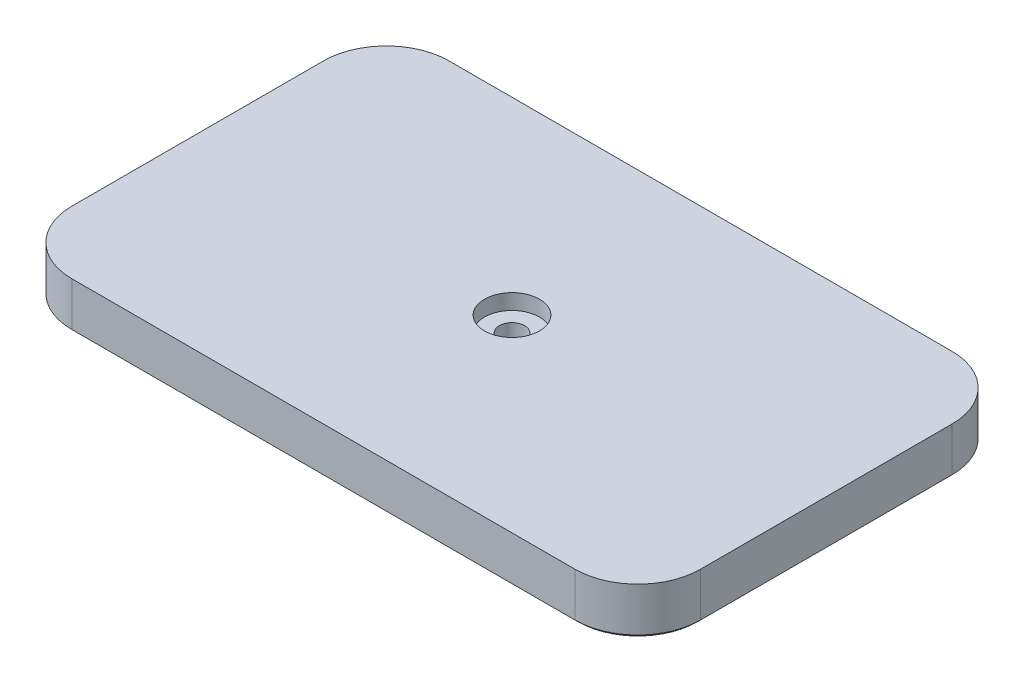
SolidWorks part; units mm, degrees
ref_plane "Plane1" through (0, 0, 0) normal (0, 0, 1) x (1, 0, 0)
ref_plane "Plane2" through (0, 0, 0) normal (0, 1, 0) x (1, 0, 0)
ref_plane "Plane3" through (0, 0, 0) normal (1, 0, 0) x (0, 0, -1)
sketch "Sketch1" plane through (0, 0, 0) normal (0, 1, 0) x (1, 0, 0)
  line L0 (-63.5, 38.1) -> (63.5, -38.1) construction
  line L1 (-63.5, 38.1) -> (63.5, 38.1)
  line L2 (-63.5, 38.1) -> (-63.5, -38.1)
  line L3 (-63.5, -38.1) -> (63.5, -38.1)
  line L4 (63.5, 38.1) -> (63.5, -38.1)
  dimension "D1" = 127
  dimension "D2" = 76.2
extrude "Extrude1" add sketch "Sketch1" along normal blind 9.525
fillet "Fillet1" radius 12.7 4 edges at (-63.5, 4.7625, -38.1) (63.5, 4.7625, -38.1) (-63.5, 4.7625, 38.1) (63.5, 4.7625, 38.1)
chamfer "Chamfer1" distance 0.635 angle 45 8 edges at (0, 0, 38.1) (63.5, 0, 0) (0, 0, -38.1) (-63.5, 0, 0) (-59.7803, 0, 34.3803) (59.7803, 0, 34.3803) (59.7803, 0, -34.3803) (-59.7803, 0, -34.3803)
hole_wizard "CBORE for #10 Binding Head Machine Screw2" positions "Sketch3" profile "Sketch2" counterbore size "#10" standard "Ansi Inch"
sketch "Sketch3" plane through (0, 9.525, 0) normal (0, 1, 0) x (-1, 0, 0)
  line L0 (50.8, -25.4) -> (-50.8, 25.4) construction
  point P0 (0, 0)
sketch "Sketch2" plane through (0, 9.525, 0) normal (1, 0, 0) x (0, 0, 1)
  line L0 (0, 0) -> (0, 9.525)
  line L1 (0, 9.525) -> (2.5527, 9.525)
  line L3 (2.5527, 9.525) -> (2.5527, 3.1242)
  line L4 (2.5527, 3.1242) -> (5.5562, 3.1242)
  line L5 (5.5562, 3.1242) -> (5.5562, 0)
  line L7 (5.5562, 0) -> (0, 0)
  line L11 (0, -6.35) -> (0, 107.95) construction
  dimension "Thru Hole Dia." = 5.1054
  dimension "Thru Hole Depth" = 9.525
  dimension "C'Bore Dia." = 11.1125
  dimension "C'Bore Depth" = 3.1242
